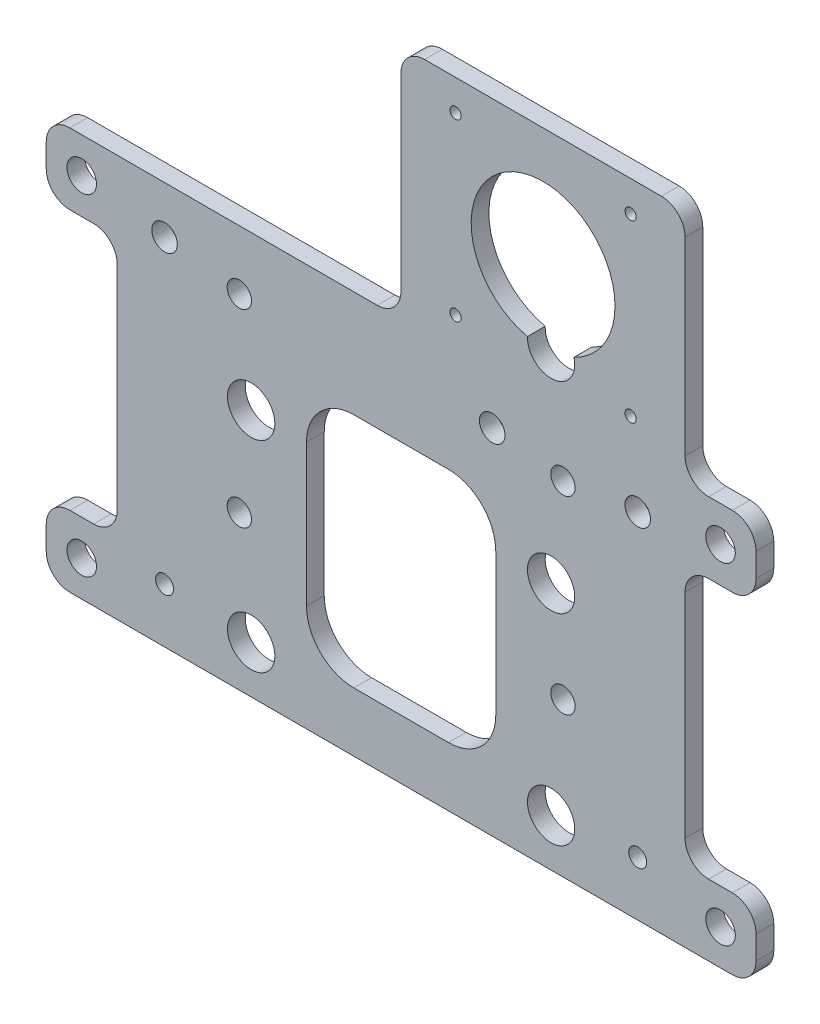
SolidWorks part; units mm, degrees
ref_plane "Front Plane" through (0, 0, 0) normal (0, 0, 1) x (1, 0, 0)
ref_plane "Top Plane" through (0, 0, 0) normal (0, 1, 0) x (1, 0, 0)
ref_plane "Right Plane" through (0, 0, 0) normal (1, 0, 0) x (0, 0, -1)
sketch "Sketch1" plane through (0, 0, 0) normal (0, 0, 1) x (1, 0, 0)
  line L0 (40.5776, 33.5043) -> (40.5776, -93.4957) construction
  line L1 (-35.6224, 33.5043) -> (116.7776, 33.5043)
  line L2 (-35.6224, 33.5043) -> (-35.6224, -93.4957)
  line L3 (-35.6224, -93.4957) -> (116.7776, -93.4957)
  line L4 (116.7776, 33.5043) -> (116.7776, -93.4957)
  line L5 (-35.6224, -29.9957) -> (116.7776, -29.9957) construction
  dimension "D1" = 152.4
  dimension "D2" = 127
extrude "Boss-Extrude1" add sketch "Sketch1" along normal blind 4.7625
sketch "Sketch2" plane through (0, 0, 4.7625) normal (0, 0, 1) x (1, 0, 0)
  line L0 (116.7776, 33.5043) -> (-35.6224, 33.5043) construction
  line L1 (-35.6224, 33.5043) -> (-35.6224, -93.4957) construction
  line L3 (-35.6224, -29.9957) -> (118.5835, -29.9957) construction
  circle A0 centre (-22.9224, 20.8043) radius 3.429
  circle A1 centre (104.0776, 20.4284) radius 3.429
  circle A2 centre (-22.9224, -59.8356) radius 2.413
  circle A3 centre (104.0776, -59.8356) radius 2.413
  circle A7 centre (65.0251, 20.4284) radius 3.429
  point P8 (40.5776, 33.5043)
  point P11 (40.5776, 33.5043)
  point P18 (-35.6224, -29.9957)
  dimension "D1" = 6.858
  dimension "D11" = 6.858
  dimension "D3" = 4.826
  dimension "D4" = 4.826
  dimension "D15" = 6.858
  dimension "D5" = 63.5
  dimension "D6" = 63.5
  dimension "D7" = 80.6399
  dimension "D8" = 80.264
  dimension "D9" = 50.8
extrude "Cut-Extrude1" cut sketch "Sketch2" against normal through all
sketch "Sketch4" plane through (0, 0, 4.7625) normal (0, 0, 1) x (1, 0, 0)
  line L1 (116.7776, 33.5043) -> (40.518, 33.5043)
  line L2 (116.7776, 33.5043) -> (116.7776, 97.0043)
  line L3 (116.7776, 97.0043) -> (40.518, 97.0043)
  line L4 (40.518, 33.5043) -> (40.518, 97.0043)
  dimension "D1" = 63.5
extrude "Boss-Extrude2" add sketch "Sketch4" against normal up to surface (4.7625 mm away)
ref_plane "Plane1" through (40.5776, 0, 0) normal (-1, 0, 0) x (0, 0, 1)
sketch "Sketch7" plane through (0, 0, 4.7625) normal (0, 0, 1) x (1, 0, 0)
  line L0 (40.5776, 3.4925) -> (40.5776, -3.4925) construction
  line L1 (116.7776, 97.0043) -> (40.518, 97.0043) construction
  circle A0 centre (78.6776, 65.2543) radius 19.304
  dimension "D1" = 38.608
  dimension "D2" = 38.1
  dimension "D3" = 31.75
extrude "Cut-Extrude3" cut sketch "Sketch7" against normal through all
sketch "Sketch8" plane through (0, 0, 0) normal (0, 0, -1) x (-1, 0, 0)
  line L0 (35.6224, 33.5043) -> (35.6224, -93.4957) construction
  line L1 (-116.7776, -93.4957) -> (35.6224, -93.4957)
  line L2 (-116.7776, -93.4957) -> (-116.7776, -74.4457)
  line L3 (-116.7776, -74.4457) -> (35.6224, -74.4457)
  line L4 (35.6224, -93.4957) -> (35.6224, -74.4457)
  dimension "D1" = 19.05
extrude "Cut-Extrude4" cut sketch "Sketch8" against normal through all
sketch "Sketch9" plane through (0, 0, 4.7625) normal (0, 0, 1) x (1, 0, 0)
  circle A0 centre (55.1826, 88.7493) radius 1.5 construction
  circle A1 centre (55.1826, 41.7593) radius 1.5 construction
  circle A2 centre (102.1726, 88.7493) radius 1.5 construction
  circle A3 centre (102.1726, 41.7593) radius 1.5 construction
  circle A4 centre (55.1826, 88.7493) radius 1.5
  circle A5 centre (55.1826, 41.7593) radius 1.5
  circle A6 centre (102.1726, 88.7493) radius 1.5
  circle A7 centre (102.1726, 41.7593) radius 1.5
extrude "Cut-Extrude5" cut sketch "Sketch9" against normal through all
sketch "Sketch12" plane through (0, 0, 0) normal (0, 0, -1) x (-1, 0, 0)
  line L0 (-116.7776, -74.4457) -> (-116.7776, 97.0043) construction
  line L1 (35.6224, 33.5043) -> (54.6724, 33.5043)
  line L2 (35.6224, 33.5043) -> (35.6224, 14.4543)
  line L3 (35.6224, 14.4543) -> (54.6724, 14.4543)
  line L4 (54.6724, 33.5043) -> (54.6724, 14.4543)
  line L5 (-116.7776, 33.5043) -> (-135.8276, 33.5043)
  line L6 (-116.7776, 33.5043) -> (-116.7776, 14.4543)
  line L7 (-116.7776, 14.4543) -> (-135.8276, 14.4543)
  line L8 (-135.8276, 33.5043) -> (-135.8276, 14.4543)
  line L10 (35.6224, -74.4457) -> (54.6724, -74.4457)
  line L11 (35.6224, -74.4457) -> (35.6224, -55.3957)
  line L12 (35.6224, -55.3957) -> (54.6724, -55.3957)
  line L13 (54.6724, -74.4457) -> (54.6724, -55.3957)
  line L14 (-116.7776, -74.4457) -> (-135.8276, -74.4457)
  line L15 (-116.7776, -74.4457) -> (-116.7776, -55.3957)
  line L16 (-116.7776, -55.3957) -> (-135.8276, -55.3957)
  line L17 (-135.8276, -74.4457) -> (-135.8276, -55.3957)
  dimension "D1" = 19.05
  dimension "D2" = 19.05
  dimension "D3" = 19.05
  dimension "D4" = 19.05
  dimension "D5" = 19.05
  dimension "D6" = 19.05
  dimension "D7" = 19.05
  dimension "D8" = 19.05
extrude "Boss-Extrude3" add sketch "Sketch12" against normal up to surface (4.7625 mm away)
hole_wizard "5/16 (0.3125) Diameter Hole1" positions "Sketch11" profile "Sketch10" hole size "5/16" standard "Ansi Inch"
sketch "Sketch11" plane through (0, 0, 0) normal (0, 0, -1) x (-1, 0, 0)
  line L0 (54.6724, -74.4457) -> (-135.8276, -74.4457) construction
  line L1 (-40.5776, -3.4925) -> (-40.5776, 3.4925) construction
  line L2 (-40.518, 33.5043) -> (54.6724, 33.5043) construction
  point P0 (-126.3026, -64.9207)
  point P1 (45.1474, -64.9207)
  point P3 (-126.3026, 23.9793)
  point P5 (45.1474, 23.9793)
  dimension "D1" = 9.525
  dimension "D2" = 85.725
  dimension "D3" = 85.725
  dimension "D4" = 85.725
  dimension "D5" = 85.725
  dimension "D6" = 9.525
sketch "Sketch10" plane through (126.3026, -64.9207, 0) normal (1, 0, 0) x (0, 1, 0)
  line L0 (0, 0) -> (0, 4.7625)
  line L1 (0, 4.7625) -> (3.9687, 4.7625)
  line L2 (3.9687, 4.7625) -> (3.9687, 0)
  line L5 (3.9687, 0) -> (0, 0)
  line L11 (0, -6.35) -> (0, 107.95) construction
  dimension "Thru Hole Dia." = 7.9375
  dimension "Thru Hole Depth" = 4.7626
fillet "Fillet1" radius 6.35 16 edges at (116.7776, 97.0043, 2.3813) (135.8276, 33.5043, 2.3812) (135.8276, 14.4543, 2.3812) (116.7776, -55.3957, 2.3813) (135.8276, -55.3957, 2.3812) (135.8276, -74.4457, 2.3812) (-54.6724, -74.4457, 2.3812) (-54.6724, -55.3957, 2.3812) (-35.6224, -55.3957, 2.3812) (-54.6724, 14.4543, 2.3812) (-54.6724, 33.5043, 2.3812) (40.518, 97.0043, 2.3813)
hole_wizard "1/2 (0.5) Diameter Hole1" positions "Sketch14" profile "Sketch13" hole size "1/2" standard "Ansi Inch"
sketch "Sketch14" plane through (0, 0, 0) normal (0, 0, -1) x (-1, 0, 0)
  point P1 (-80.8276, 46.2043)
  point P7 (-80.8276, -7.7707)
  point P10 (-80.8276, -61.7457)
sketch "Sketch13" plane through (80.8276, 46.2043, 0) normal (1, 0, 0) x (0, 1, 0)
  line L0 (0, 0) -> (0, 4.7625)
  line L1 (0, 4.7625) -> (6.35, 4.7625)
  line L2 (6.35, 4.7625) -> (6.35, 0)
  line L5 (6.35, 0) -> (0, 0)
  line L11 (0, -6.35) -> (0, 107.95) construction
  dimension "Thru Hole Dia." = 12.7
  dimension "Thru Hole Depth" = 4.7625
hole_wizard "5/16-18 Tapped Hole1" positions "Sketch16" profile "Sketch15" tap size "5/16-18" standard "Ansi Inch"
sketch "Sketch16" plane through (0, 0, 0) normal (0, 0, -1) x (-1, 0, 0)
  point P1 (-84.0026, 17.6293)
  point P4 (-84.0026, -33.1707)
sketch "Sketch15" plane through (84.0026, 17.6293, 0) normal (1, 0, 0) x (0, 1, 0)
  line L0 (0, 0) -> (0, 4.7625)
  line L1 (0, 4.7625) -> (3.2639, 4.7625)
  line L2 (3.2639, 4.7625) -> (3.2639, 0)
  line L5 (3.2639, 0) -> (0, 0)
  line L11 (0, -6.35) -> (0, 107.95) construction
  dimension "Thread Major Dia." = 6.5278
  dimension "Thru Tap Drill Depth" = 4.7625
mirror "Mirror1" about plane through (40.5776, 0, 0) normal (-1, 0, 0) of "5/16-18 Tapped Hole1", "1/2 (0.5) Diameter Hole1"
sketch "Sketch17" plane through (0, 0, 0) normal (0, 0, -1) x (-1, 0, 0)
  line L0 (48.3224, -74.4457) -> (-129.4776, -74.4457) construction
  line L1 (-65.9776, 4.9293) -> (-15.1776, 4.9293)
  line L2 (-65.9776, 4.9293) -> (-65.9776, -58.5707)
  line L3 (-65.9776, -58.5707) -> (-15.1776, -58.5707)
  line L4 (-15.1776, 4.9293) -> (-15.1776, -58.5707)
  line L5 (-40.5776, -3.4925) -> (-40.5776, 3.4925) construction
  dimension "D1" = 15.875
  dimension "D2" = 63.5
  dimension "D3" = 25.4
  dimension "D4" = 50.8
extrude "Cut-Extrude6" cut sketch "Sketch17" against normal through all
fillet "Fillet2" radius 12.7 4 edges at (15.1776, 4.9293, 2.3813) (15.1776, -58.5707, 2.3813) (65.9776, -58.5707, 2.3813) (65.9776, 4.9293, 2.3813)
